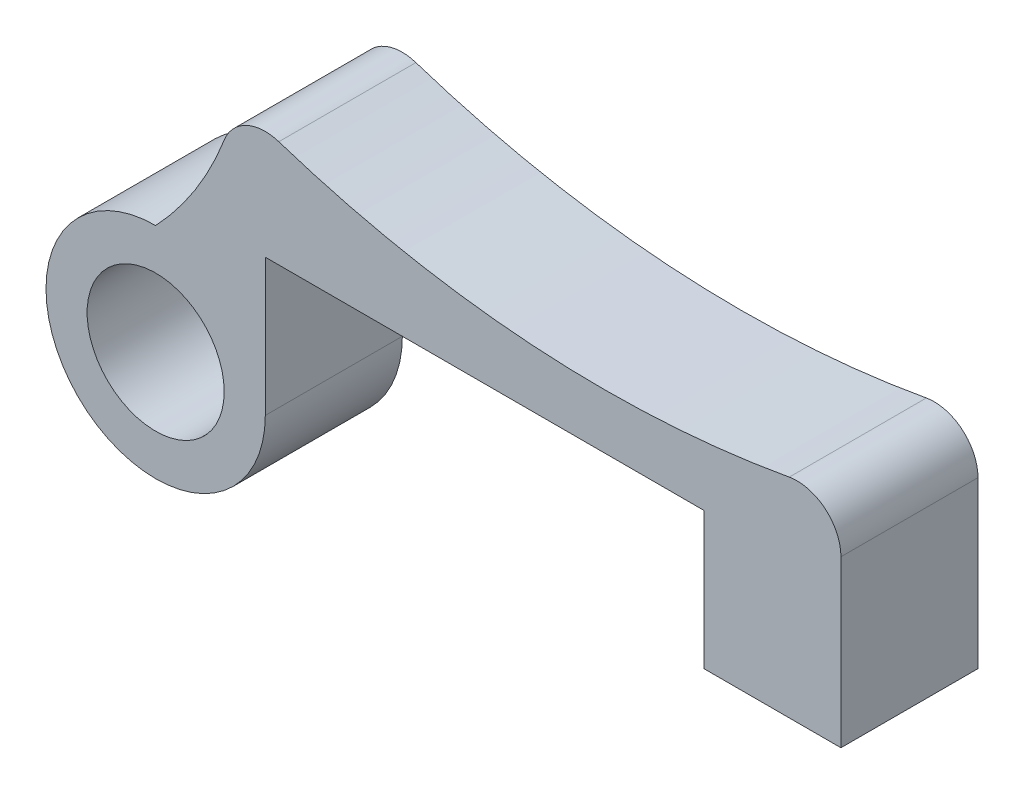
SolidWorks part; units mm, degrees
ref_plane "Front Plane" through (0, 0, 0) normal (0, 0, 1) x (1, 0, 0)
ref_plane "Top Plane" through (0, 0, 0) normal (0, 1, 0) x (1, 0, 0)
ref_plane "Right Plane" through (0, 0, 0) normal (1, 0, 0) x (0, 0, -1)
sketch "Sketch1" plane through (0, 0, 0) normal (0, 0, 1) x (1, 0, 0)
  line L0 (2.54, 0) -> (2.54, 3.175)
  line L1 (2.54, 3.175) -> (12.7, 3.175)
  line L2 (12.7, 3.175) -> (12.7, 0)
  line L3 (12.7, 0) -> (15.875, 0)
  line L4 (15.875, 0) -> (15.875, 5.08)
  circle A0 centre (0, 0) radius 2.54
  circle A1 centre (0, 0) radius 1.5875
  arc A2 (0, 2.54) -> (1.8835, 5.9888) centre (-5.5198, 7.7932) ccw
  arc A3 (1.8835, 5.9888) -> (15.875, 5.08) centre (10.3757, 28.575) ccw
  point P14 (10.0762, 5.8483)
  point P15 (9.9602, 4.5854)
  point P16 (1.3436, 4.6258)
  point P17 (0, 0)
  point P18 (2.0863, 5.6912)
  point P19 (1.4939, 5.898)
  point P20 (1.8291, 5.7789)
  dimension "D2" = 5.08
  dimension "D3" = 3.175
  dimension "D6" = 25.4
  dimension "D8" = 7.62
  dimension "D9" = 24.13
  dimension "D1" = 3.175
  dimension "D4" = 3.175
  dimension "D5" = 10.16
  dimension "D7" = 3.175
  dimension "D10" = 5.08
extrude "Boss-Extrude1" add sketch "Sketch1" along normal blind 3.175 contours A3 A2 A0 L0 L1 L2 L3 L4 | A0 A1
fillet "Fillet1" radius 1.016 1 edges at (1.8835, 5.9888, 1.5875)
fillet "Fillet2" radius 1.016 1 edges at (15.875, 5.08, 1.5875)
